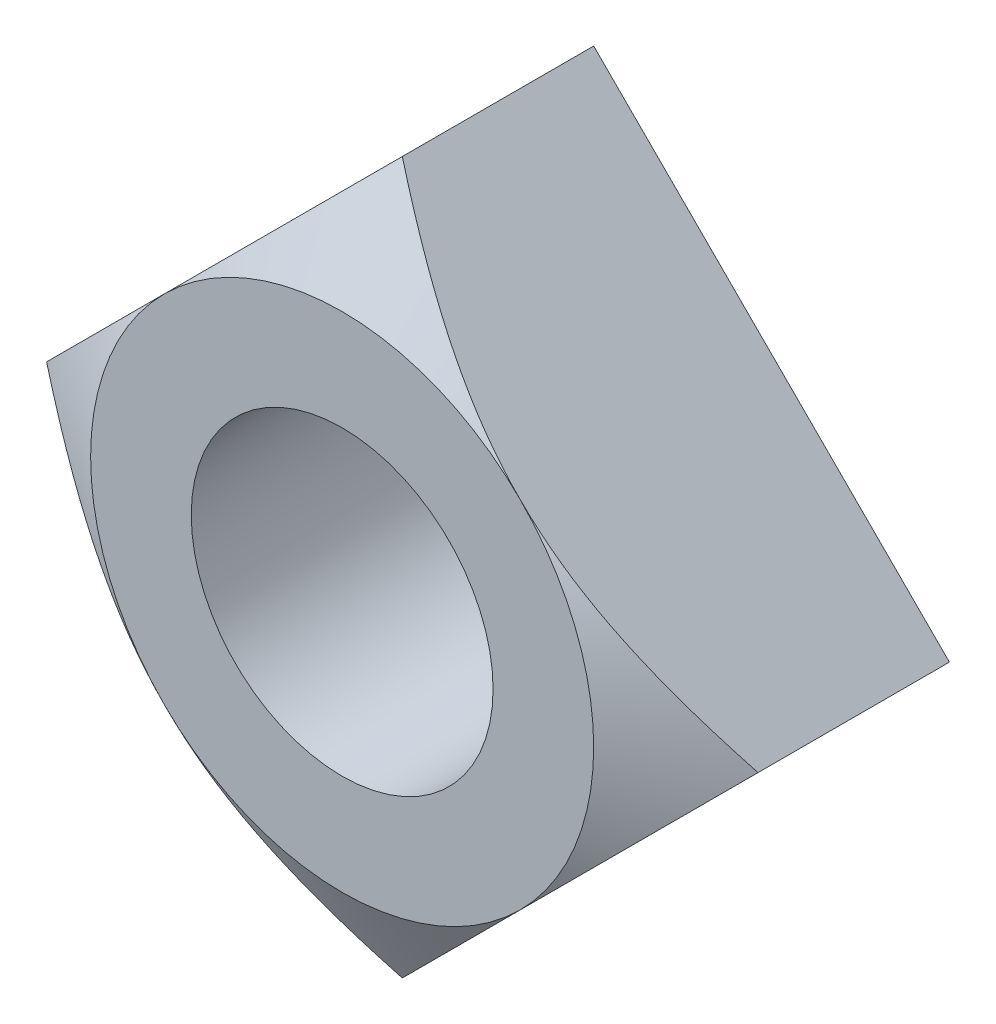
SolidWorks part; units mm, degrees
ref_plane "Front" through (0, 0, 0) normal (0, 0, 1) x (1, 0, 0)
ref_plane "Top" through (0, 0, 0) normal (0, 1, 0) x (1, 0, 0)
ref_plane "Right" through (0, 0, 0) normal (1, 0, 0) x (0, 0, -1)
sketch "Sketch1" plane through (0, 0, 0) normal (0, 0, 1) x (1, 0, 0)
  line L0 (0, 7.0711) -> (-7.0711, 0)
  line L1 (-7.0711, 0) -> (0, -7.0711)
  line L2 (0, -7.0711) -> (7.0711, 0)
  line L3 (7.0711, 0) -> (0, 7.0711)
extrude "Extrude1" add sketch "Sketch1" along normal blind 5
ref_plane "Plane1" through (0, 0, 0) normal (-0.7071, 0.7071, 0) x (-0.7071, -0.7071, 0)
sketch "Sketch2" plane through (0, 0, 0) normal (-0.7071, 0.7071, 0) x (-0.7071, -0.7071, 0)
  line L0 (-5, 5) -> (-10, 5)
  line L1 (-10, 5) -> (-10, 2.1132)
  line L2 (-10, 2.1132) -> (-5, 5)
  line L3 (0, 0) -> (0, 5) construction
  line L4 (-5, 0) -> (5, 0) construction
  line L5 (-5, 5) -> (5, 5) construction
revolve "Cut-Revolve1" cut sketch "Sketch2" angle 360 about L3
sketch "Sketch3" plane through (0, 0, 5) normal (0, 0, 1) x (1, 0, 0)
  circle A0 centre (0, 0) radius 3
  dimension "d" = 6
extrude "Cut-Extrude1" cut sketch "Sketch3" against normal through all
equation "\"D1@Plane1\" = \"S@Sketch1\" / 2"
equation "\"D2@Sketch2\" = \"S@Sketch1\" / 2"
